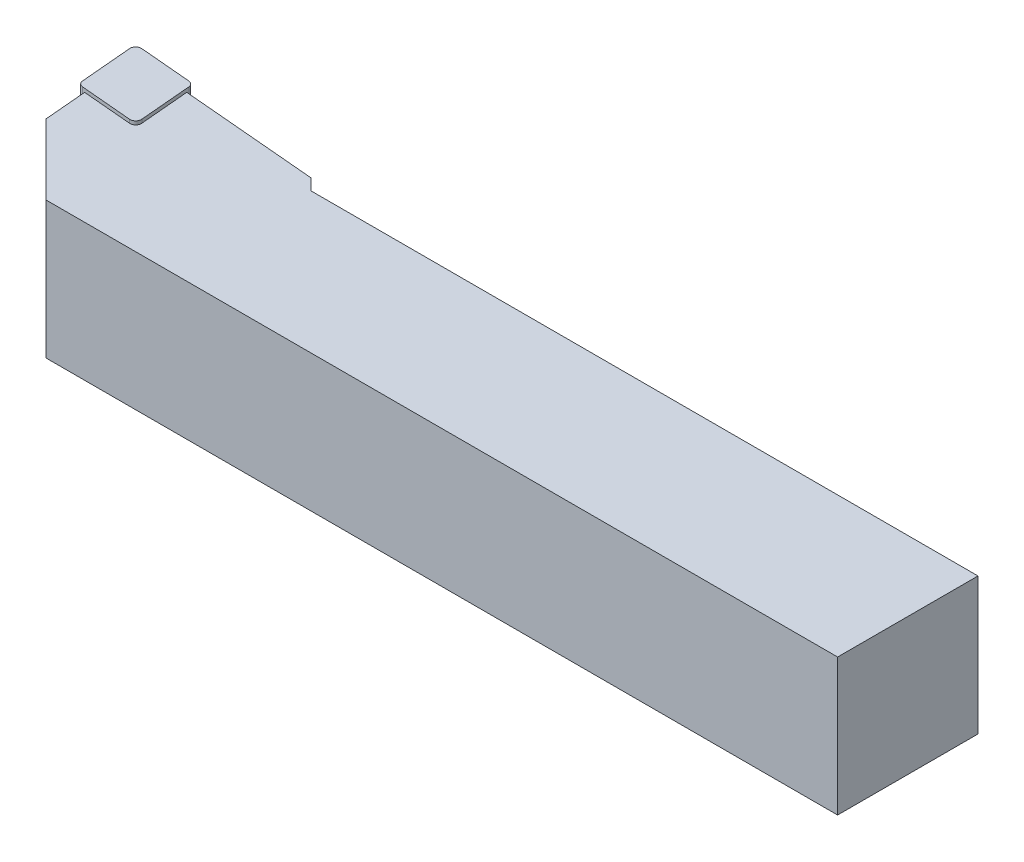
SolidWorks part; units mm, degrees
ref_plane "Plan1" through (0, 0, 0) normal (0, 0, 1) x (1, 0, 0)
ref_plane "Plan2" through (0, 0, 0) normal (0, 1, 0) x (1, 0, 0)
ref_plane "Plan3" through (0, 0, 0) normal (1, 0, 0) x (0, 0, -1)
sketch "EsqPlaquette" plane through (0, 0, 0) normal (0, 1, 0) x (1, 0, 0)
  line L0 (-10, 0) -> (10, 0) construction
  line L1 (0, 7.3661) -> (0, -10.2271) construction
  line L2 (0.6458, -8.217) -> (0.003, -0.8697)
  line L3 (0.8697, -0.003) -> (8.217, -0.6458)
  line L4 (8.9442, -1.3731) -> (9.587, -8.7203)
  line L5 (8.7203, -9.587) -> (1.3731, -8.9442)
  arc A0 (0.8697, -0.003) -> (0.003, -0.8697) centre (0.8, -0.8) ccw
  arc A1 (1.3731, -8.9442) -> (0.6458, -8.217) centre (1.4428, -8.1473) cw
  arc A2 (9.587, -8.7203) -> (8.7203, -9.587) centre (8.7901, -8.7901) cw
  arc A3 (8.217, -0.6458) -> (8.9442, -1.3731) centre (8.1473, -1.4428) cw
  point P11 (-0.0801, 0.0801)
  point P16 (9.6701, -9.6701)
  point P19 (8.8857, -0.7044)
  dimension "D1" = 80
  dimension "RBec" = 0.8
  dimension "D3" = 9
  dimension "D5" = 5
  dimension "LU" = 9
extrude "Plaquette" add sketch "EsqPlaquette" against normal blind 4.76
ref_plane "Plan4" through (0, -0.5, 0) normal (0, 1, 0) x (-1, 0, 0)
sketch "EsqCorps" plane through (0, -0.5, 0) normal (0, 1, 0) x (-1, 0, 0)
  line L0 (0, 0) -> (-28, 0) construction
  line L1 (-125, 5) -> (-125, 25)
  line L3 (-125, 25) -> (-12.2248, 25)
  line L4 (-125, 5) -> (-30, 5)
  line L5 (-1, 1) -> (-28.3969, 3.3969)
  line L6 (-1, 1) -> (-2.2248, 15)
  line L7 (-2.2248, 15) -> (-12.2248, 25)
  line L8 (-30, 5) -> (-28.3969, 3.3969)
  dimension "D1" = 1
  dimension "D2" = 1
  dimension "D3" = 80
  dimension "D4" = 5
  dimension "D5" = 25
  dimension "D6" = 20
  dimension "D7" = 30
  dimension "D8" = 125
  dimension "D9" = 135
  dimension "D10" = 135
  dimension "D11" = 10
extrude "CorpsOutil" add sketch "EsqCorps" against normal blind 19.5
